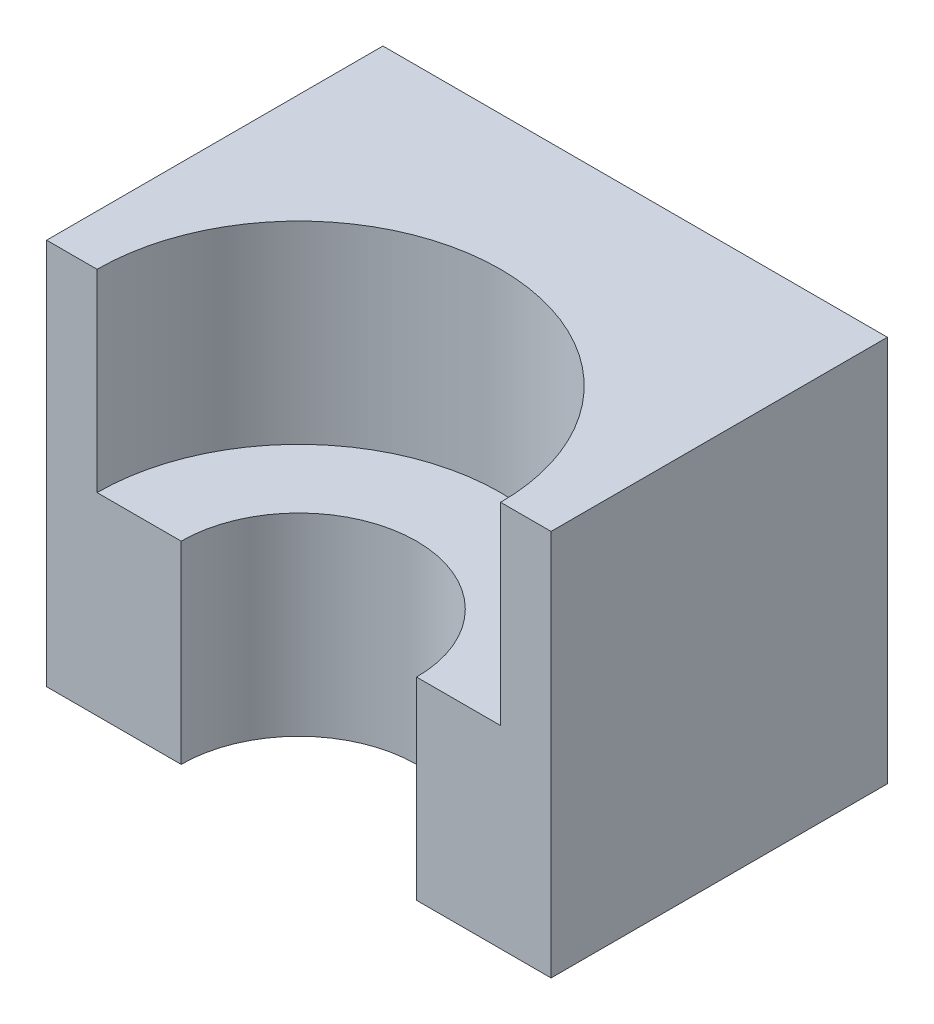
SolidWorks part; units mm, degrees
ref_plane "前视基准面" through (0, 0, 0) normal (0, 0, 1) x (1, 0, 0)
ref_plane "上视基准面" through (0, 0, 0) normal (0, 1, 0) x (1, 0, 0)
ref_plane "右视基准面" through (0, 0, 0) normal (1, 0, 0) x (0, 0, -1)
sketch "草图1" plane through (0, 0, 0) normal (0, 0, 1) x (1, 0, 0)
  line L0 (0, 0) -> (0, 96.7463) construction
  line L1 (-15, 11.5) -> (15, 11.5)
  line L2 (-15, 11.5) -> (-15, -11.5)
  line L3 (-15, -11.5) -> (15, -11.5)
  line L4 (15, 11.5) -> (15, -11.5)
  line L5 (0, 96.7463) -> (0, 0) construction
  line L6 (0, 0) -> (104.775, 0) construction
extrude "拉伸1" add sketch "草图1" against normal blind 20
sketch "草图2" plane through (0, 0, 0) normal (0, 0, 1) x (1, 0, 0)
  line L0 (0, 0) -> (0, 15.1034) construction
  line L1 (12, 11.5) -> (12, 0)
  line L2 (15, 11.5) -> (-15, 11.5) construction
  line L3 (12, 0) -> (7, 0)
  line L4 (7, 0) -> (7, -11.5)
  line L5 (-15, -11.5) -> (15, -11.5) construction
  line L6 (7, -11.5) -> (0, -11.5)
  line L7 (0, -11.5) -> (0, 11.5)
  line L8 (0, 11.5) -> (12, 11.5)
  line L9 (12, 11.5) -> (7.8621, 11.4483)
revolve "切除-旋转1" cut sketch "草图2" angle 360 about L0
